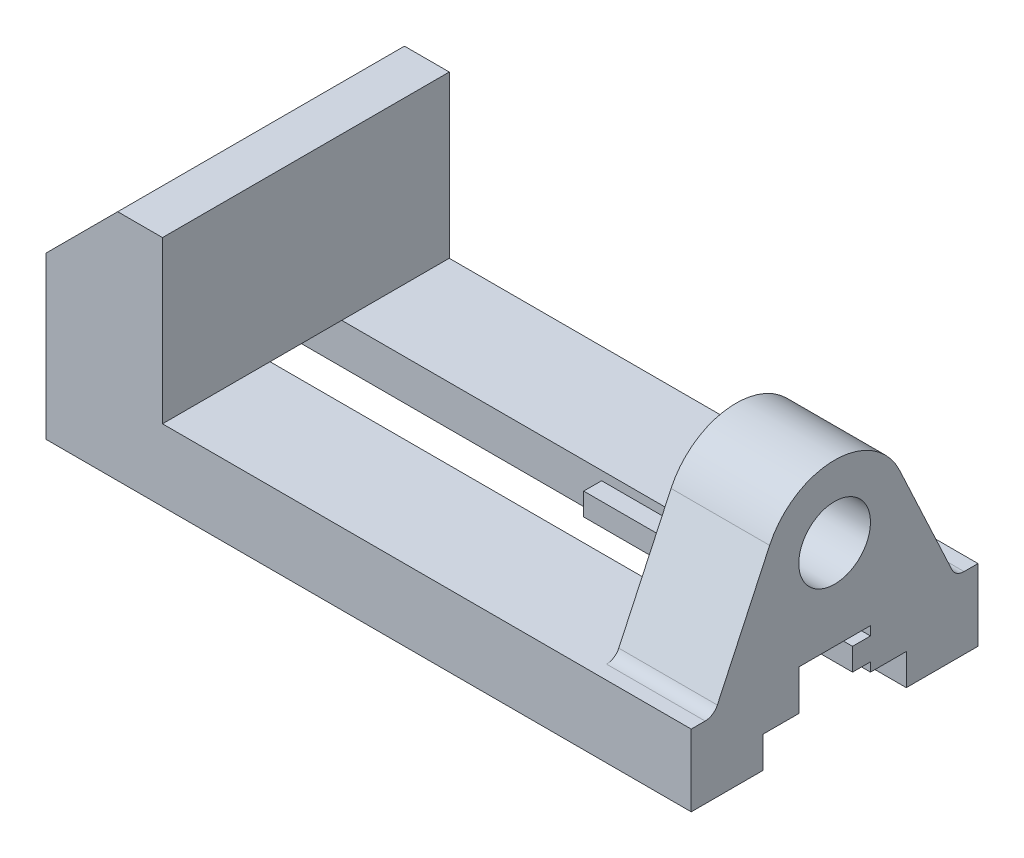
SolidWorks part; units mm, degrees
ref_plane "Front Plane" through (0, 0, 0) normal (0, 0, 1) x (1, 0, 0)
ref_plane "Top Plane" through (0, 0, 0) normal (0, 1, 0) x (1, 0, 0)
ref_plane "Right Plane" through (0, 0, 0) normal (1, 0, 0) x (0, 0, -1)
sketch "Sketch1" plane through (0, 0, 0) normal (0, 0, 1) x (1, 0, 0)
  line L0 (144, 0) -> (0, 0)
  line L1 (0, 0) -> (0, 36)
  line L2 (0, 36) -> (16, 52)
  line L3 (16, 52) -> (26, 52)
  line L4 (26, 52) -> (26, 16)
  line L5 (26, 16) -> (144, 16)
  line L6 (144, 16) -> (144, 0)
  dimension "D1" = 144
  dimension "D2" = 16
  dimension "D3" = 36
  dimension "D4" = 16
  dimension "D5" = 10
  dimension "D6" = 16
extrude "Base" add sketch "Sketch1" along normal mid plane 64
sketch "Sketch2" plane through (144, 0, 0) normal (1, 0, 0) x (0, 0, -1)
  line L0 (-14.5009, 42.7619) -> (-26.9802, 16)
  line L1 (-32, 16) -> (32, 16) construction
  line L2 (26.9802, 16) -> (14.5009, 42.7619)
  line L3 (-32, 16) -> (32, 16) construction
  line L4 (-26.9802, 16) -> (26.9802, 16)
  line L5 (-32, 52) -> (32, 52) construction
  line L6 (0, 36) -> (0, 16) construction
  arc A0 (-14.5009, 42.7619) -> (14.5009, 42.7619) centre (0, 36) cw
  dimension "D1" = 16
  dimension "D2" = 50
extrude "Left end" add sketch "Sketch2" against normal blind 22
sketch "Sketch3" plane through (144, 0, 0) normal (1, 0, 0) x (0, 0, -1)
  line L0 (-16, 0) -> (-16, 7)
  line L1 (-32, 0) -> (32, 0) construction
  line L2 (-16, 7) -> (-8, 7)
  line L3 (-8, 7) -> (-8, 16)
  line L4 (-32, 16) -> (32, 16) construction
  line L5 (-8, 16) -> (8, 16)
  line L6 (8, 16) -> (8, 7)
  line L7 (8, 7) -> (16, 7)
  line L8 (16, 7) -> (16, 0)
  line L9 (16, 0) -> (-16, 0)
  point P4 (0, 0)
  point P13 (0, 16)
  dimension "D1" = 32
  dimension "D2" = 16
  dimension "D3" = 7
  dimension "D4" = 16
extrude "Cut Extrude" cut sketch "Sketch3" against normal through all
other "Dia 16 Hole"
sketch "Sketch4" plane through (144, 0, 0) normal (1, 0, 0) x (0, 0, -1)
  circle A0 centre (0, 36) radius 8
  arc A1 (14.5009, 42.7619) -> (-14.5009, 42.7619) centre (0, 36) ccw construction
  dimension "D1" = 16
hole_wizard "Ø6.0 (6) Diameter Hole1" positions "3DSketch1" profile "Sketch5" hole size "Ø6.0" standard "Ansi Metric"
sketch3d "3DSketch1"
  line L0 (144, 0, 32) -> (144, 0, 16) construction
  line L1 (0, 0, 32) -> (144, 0, 32) construction
  point P0 (106, 0, 22)
  dimension "D1" = 38
  dimension "D2" = 10
sketch "Sketch5" plane through (106, 0, 22) normal (1, 0, 0) x (0, 0, -1)
  line L0 (0, 0) -> (0, 11.7321)
  line L1 (0, 11.7321) -> (3, 10)
  line L2 (3, 10) -> (3, 0)
  line L5 (3, 0) -> (0, 0)
  line L10 (0, 11.7321) -> (-3, 10) construction
  line L11 (0, -6.35) -> (0, 107.95) construction
  dimension "Hole Dia." = 6
  dimension "Hole Depth" = 10
  dimension "Drill Angle" = 120
pattern_linear "LPattern1" count 2 spacing 70 along (-1, 0, 0) count 2 spacing 44 along (0, 0, -1) of "Ø6.0 (6) Diameter Hole1"
fillet "Fillet1" radius 3 2 edges at (133, 16, -26.9802) (133, 16, 26.9802)
sketch "Sketch6" plane through (144, 0, 0) normal (1, 0, 0) x (0, 0, -1)
  line L0 (8, 7) -> (8, 16) construction
  line L1 (8, 14) -> (4, 14)
  line L2 (8, 14) -> (8, 9)
  line L3 (8, 9) -> (4, 9)
  line L4 (4, 14) -> (4, 9)
  line L5 (4, 9) -> (8, 9) construction
  line L7 (16, 7) -> (8, 7) construction
  dimension "D1" = 4
  dimension "D2" = 5
  dimension "D3" = 2
extrude "Extrude1" add sketch "Sketch6" against normal blind 60
